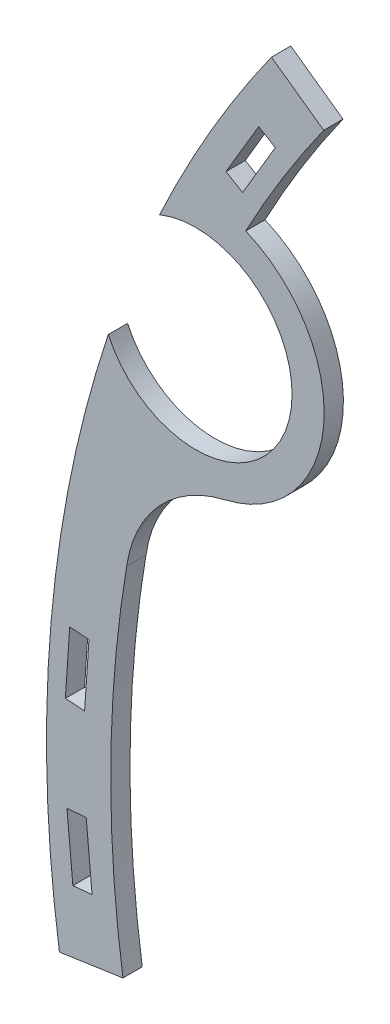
SolidWorks part; units mm, degrees
ref_plane "Ebene vorne" through (0, 0, 0) normal (0, 0, 1) x (1, 0, 0)
ref_plane "Ebene oben" through (0, 0, 0) normal (0, 1, 0) x (1, 0, 0)
ref_plane "Ebene rechts" through (0, 0, 0) normal (1, 0, 0) x (0, 0, -1)
sketch "Skizze1" plane through (0, 0, 0) normal (0, 0, 1) x (1, 0, 0)
  line L0 (-190.6997, -5.5403) -> (-189.2538, -1.6996) construction
  line L1 (-182.8203, 52.1885) -> (-171.2975, 77.7076) construction
  line L2 (-187.2839, -33.4342) -> (-177.3856, -31.9779)
  line L3 (-171.3219, 45.933) -> (-166.037, 59.9712) construction
  line L4 (-154.2485, 103.8553) -> (-146.1002, 98.0584)
  line L5 (-195.058, 9.9537) -> (-195.3988, 4.9653) construction
  line L6 (-195.058, 9.9537) -> (-195.3988, 4.9653) construction
  line L7 (-186.3663, 1.2692) -> (-185.6846, 11.2459)
  line L10 (-186.3663, 1.2692) -> (-183.3663, 1.0642)
  line L11 (-185.6846, 11.2459) -> (-182.6846, 11.0409)
  line L12 (-183.3663, 1.0642) -> (-182.6846, 11.0409)
  line L13 (-186.1086, -13.4555) -> (-185.1918, -23.4134)
  line L14 (-186.1086, -13.4555) -> (-183.1143, -13.1798)
  line L15 (-185.1918, -23.4134) -> (-182.1975, -23.1377)
  line L16 (-183.1143, -13.1798) -> (-182.1975, -23.1377)
  line L17 (-195.058, -21.7141) -> (-195.5165, -16.7338) construction
  line L18 (-161.3319, 84.87) -> (-156.238, 93.4754)
  line L19 (-161.3319, 84.87) -> (-158.7442, 83.3383)
  line L20 (-156.238, 93.4754) -> (-153.6504, 91.9437)
  line L21 (-158.7442, 83.3383) -> (-153.6504, 91.9437)
  line L22 (-179.6726, 10.9972) -> (-201.5408, 13.436) construction
  arc A0 (-105.3868, 153.0541) -> (0, -196.5802) centre (0, -5.8802) ccw construction
  arc A1 (-179.6726, 53.7205) -> (-171.6817, 73.8686) centre (-166.037, 59.9712) ccw
  arc A2 (-104.6132, 151.8873) -> (0, -195.1802) centre (0, -5.8802) ccw construction
  arc A3 (-154.2485, 103.8553) -> (-187.2839, -33.4342) centre (0, -5.8802) ccw
  arc A4 (-146.1002, 98.0584) -> (-158.2589, 78.3968) centre (0, -5.8802) ccw
  arc A5 (-104.6132, 151.8873) -> (0, -195.1802) centre (0, -5.8802) ccw construction
  arc A6 (-99.0868, 143.553) -> (0, -185.1802) centre (0, -5.8802) ccw construction
  arc A7 (-161.5262, 40.4865) -> (-158.2589, 78.3968) centre (-166.037, 59.9712) ccw
  circle A8 centre (-166.037, 59.9712) radius 20 construction
  circle A9 centre (-166.037, 59.9712) radius 15 construction
  arc A10 (-176.8026, 23.9117) -> (-161.5262, 40.4865) centre (-157.0154, 21.0019) cw
  arc A12 (-176.8026, 23.9117) -> (-177.3856, -31.9779) centre (0, -5.8802) ccw
  point P8 (-177.0589, 64.948)
  dimension "D2" = 30
  dimension "D6" = 20
  dimension "D1" = 70
  dimension "D3" = 28
  dimension "D7" = 3
  dimension "D8" = 10
  dimension "D4" = 10
  dimension "D5" = 5
extrude "Aufsatz-Linear austragen1" add sketch "Skizze1" along normal blind 3 contours A12 A10 A7 A4 L4 A3 A1 L2 L21 L19 L18 L20 L10 L12 L11 L7 L14 L16 L15 L13
